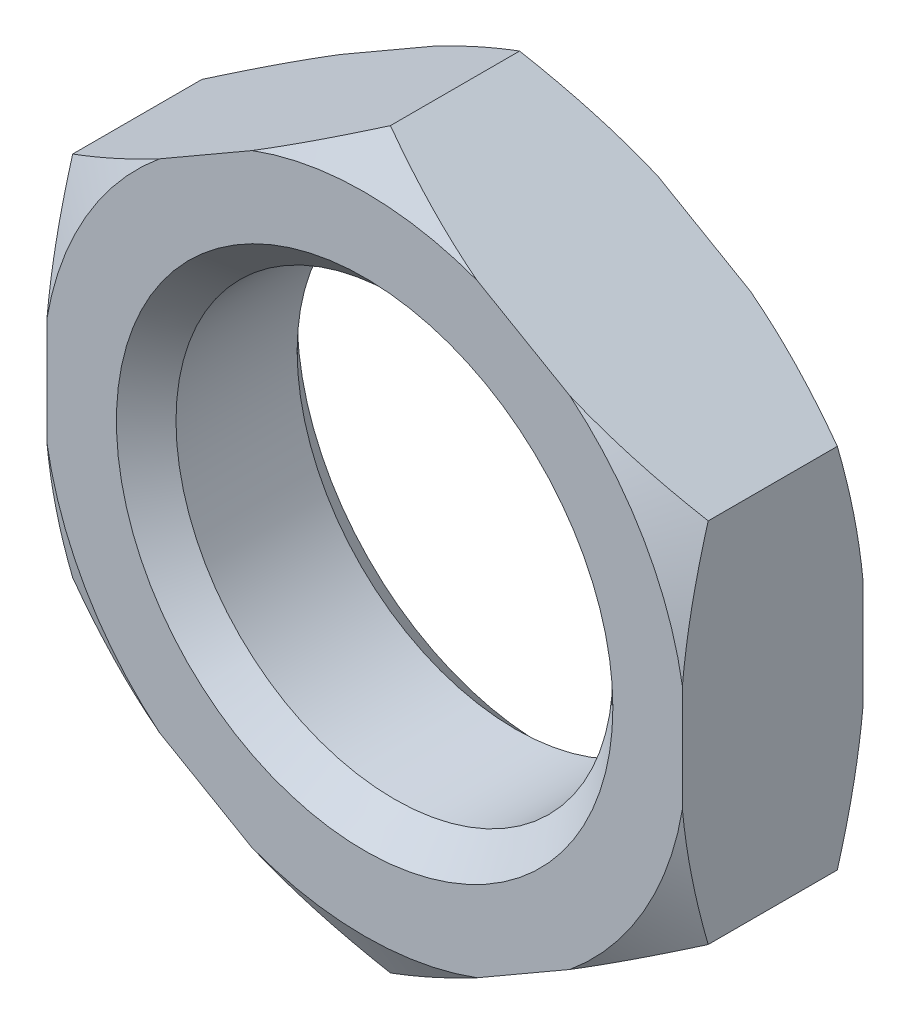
SolidWorks part; units mm, degrees
ref_plane "Front Plane" through (0, 0, 0) normal (0, 0, 1) x (1, 0, 0)
ref_plane "Top Plane" through (0, 0, 0) normal (0, 1, 0) x (1, 0, 0)
ref_plane "Right Plane" through (0, 0, 0) normal (1, 0, 0) x (0, 0, -1)
sketch "Sketch3" plane through (0, 0, 0) normal (0, 0, 1) x (1, 0, 0)
  line L1 (0, 18.4752) -> (-16, 9.2376)
  line L2 (-16, 9.2376) -> (-16, -9.2376)
  line L3 (-16, -9.2376) -> (0, -18.4752)
  line L4 (0, -18.4752) -> (16, -9.2376)
  line L5 (16, -9.2376) -> (16, 9.2376)
  line L6 (16, 9.2376) -> (0, 18.4752)
  circle A0 centre (0, 0) radius 16 construction
  dimension "D1" = 32
extrude "Boss-Extrude1" add sketch "Sketch3" along normal mid plane 9.1
sketch "Sketch4" plane through (0, 0, 0) normal (1, 0, 0) x (0, 0, -1)
  line L0 (-5.4578, 0) -> (6.1545, 0) construction
sketch "Sketch5" plane through (0, 0, 0) normal (1, 0, 0) x (0, 0, -1)
  line L0 (-4.55, 18.4752) -> (-4.55, 16.2252)
  line L1 (-4.55, 9.2376) -> (-4.55, 18.4752) construction
  line L2 (-4.55, 16.2252) -> (-3.251, 18.4752)
  line L3 (-4.55, 18.4752) -> (4.55, 18.4752) construction
  line L4 (-3.251, 18.4752) -> (-4.55, 18.4752)
  dimension "D1" = 2.25
  dimension "D2" = 30
revolve "Cut-Revolve1" cut sketch "Sketch5" angle 360 about L0
mirror "Mirror1" about plane through (0, 0, 0) normal (0, 0, 1) of "Cut-Revolve1"
sketch "Sketch6" plane through (0, 0, 4.55) normal (0, 0, 1) x (1, 0, 0)
  circle A0 centre (0, 0) radius 11
  dimension "D1" = 22
extrude "Cut-Extrude1" cut sketch "Sketch6" against normal blind 9.1
chamfer "Chamfer1" distance 1.5 angle 45 2 edges at (11, 0, -4.55) (11, 0, 4.55)
